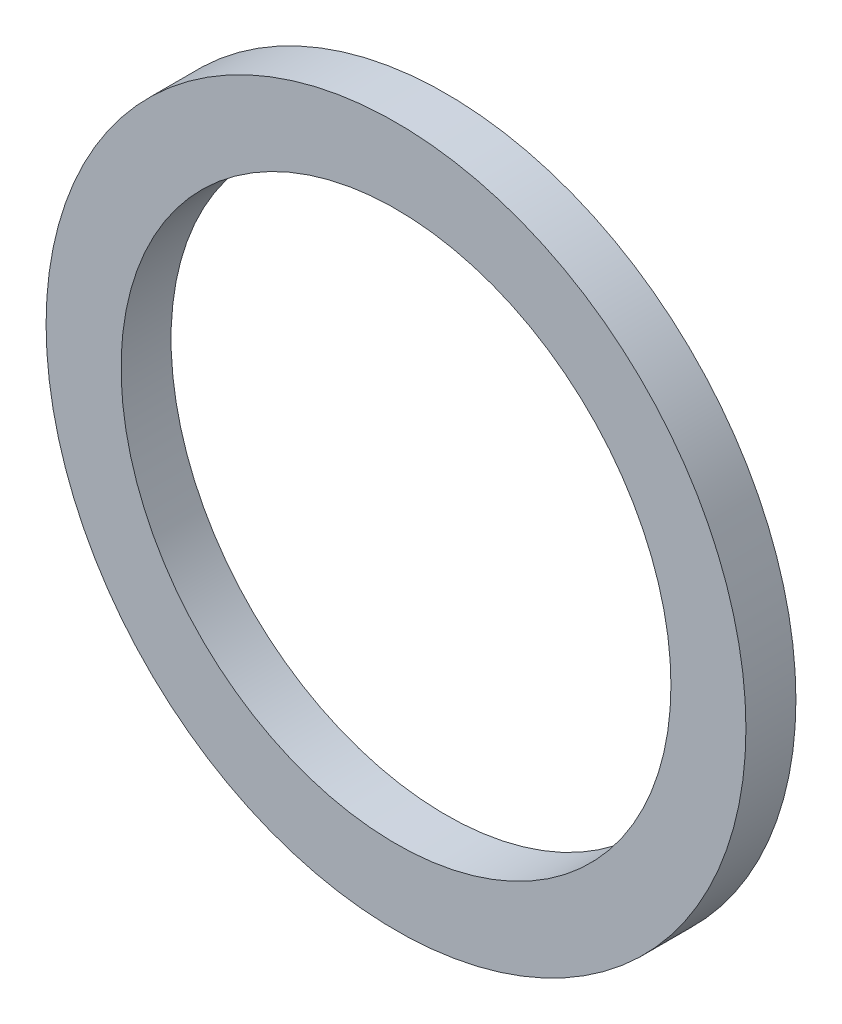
SolidWorks part; units mm, degrees
ref_plane "Plan de face" through (0, 0, 0) normal (0, 0, 1) x (1, 0, 0)
ref_plane "Plan de dessus" through (0, 0, 0) normal (0, 1, 0) x (1, 0, 0)
ref_plane "Plan de droite" through (0, 0, 0) normal (1, 0, 0) x (0, 0, -1)
sketch "Esquisse1" plane through (0, 0, 0) normal (1, 0, 0) x (0, 0, -1)
  line L0 (0, 0) -> (33.0737, 0) construction
  line L1 (0, 35) -> (5, 35)
  line L2 (5, 35) -> (5, 27.5)
  line L3 (5, 27.5) -> (0, 27.5)
  line L4 (0, 27.5) -> (0, 35)
  dimension "D1" = 55
  dimension "D2" = 70
  dimension "D3" = 5
revolve "Révolution1" add sketch "Esquisse1" angle 360 about L0
